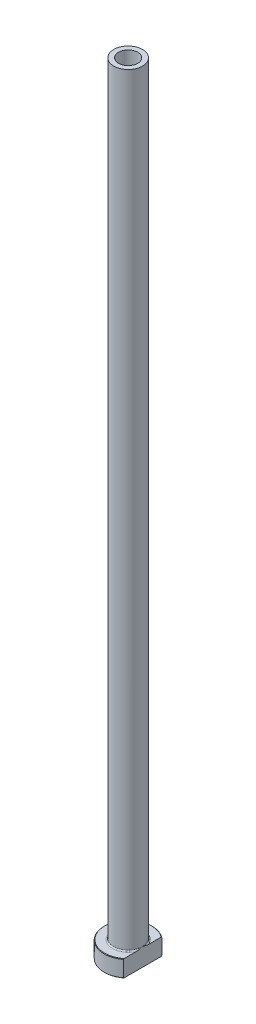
SolidWorks part; units mm, degrees
ref_plane "Front Plane" through (0, 0, 0) normal (0, 0, 1) x (1, 0, 0)
ref_plane "Top Plane" through (0, 0, 0) normal (0, 1, 0) x (1, 0, 0)
ref_plane "Right Plane" through (0, 0, 0) normal (1, 0, 0) x (0, 0, -1)
sketch "Sketch1" plane through (0, 0, 0) normal (0, 0, 1) x (1, 0, 0)
  line L0 (-4, 325) -> (-6, 325)
  line L1 (-6, 325) -> (-6, 7)
  line L2 (-6, 7) -> (-10, 7)
  line L3 (-10, 7) -> (-10, 0)
  line L4 (8.8, 0) -> (-8.8, 0) construction
  line L5 (-10, 0) -> (-4.25, 0)
  line L6 (-4, 280) -> (-4, 325)
  line L7 (0, 92.1877) -> (0, -15.5353) construction
  line L8 (0, -11) -> (0, 11) construction
  line L9 (-4, 280) -> (-4.25, 268)
  line L10 (-4.25, 268) -> (-4.25, 0)
  dimension "D1" = 0.25
  dimension "ID" = 8
  dimension "OD" = 12
  dimension "L" = 325
  dimension "H" = 20
  dimension "T" = 7
  dimension "N" = 45
  dimension "D2" = 12
  dimension "L-N" = 280
revolve "Revolve1" add sketch "Sketch1" angle 360 about L7
fillet "Fillet1" radius 0.5 1 edges at (0, 7, 6)
chamfer "Chamfer1" distance 0.2 angle 45 2 edges at (0, 7, 10) (0, 0, 10)
sketch "Sketch2" plane through (0, 0, 0) normal (0, -1, 0) x (1, 0, 0)
  line L0 (6, 8) -> (6, -8)
  circle A0 centre (0, 0) radius 10 construction
  arc A1 (6, 8) -> (6, -8) centre (0, 0) cw
  circle A2 centre (0, 0) radius 6 construction
extrude "Cut-Extrude1" cut sketch "Sketch2" against normal through all
chamfer "Chamfer2" distance 0.5 angle 45 1 edges at (0, 0, 4.25)
